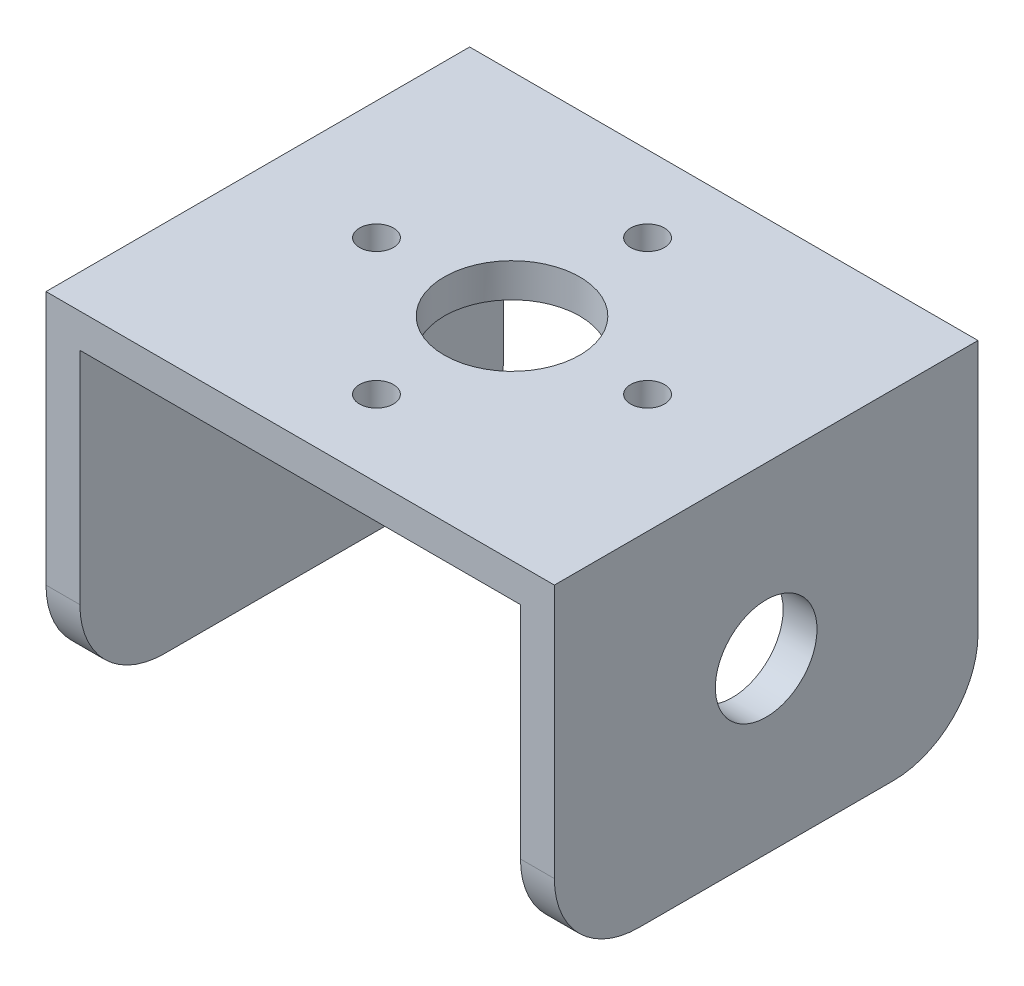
SolidWorks part; units mm, degrees
ref_plane "Front Plane" through (0, 0, 0) normal (0, 0, 1) x (1, 0, 0)
ref_plane "Top Plane" through (0, 0, 0) normal (0, 1, 0) x (1, 0, 0)
ref_plane "Right Plane" through (0, 0, 0) normal (1, 0, 0) x (0, 0, -1)
sketch "Sketch1" plane through (0, 0, 0) normal (0, 1, 0) x (1, 0, 0)
  line L1 (-15, -12.5) -> (15, -12.5)
  line L2 (-15, -12.5) -> (-15, 12.5)
  line L3 (-15, 12.5) -> (15, 12.5)
  line L4 (15, -12.5) -> (15, 12.5)
  line L5 (-15, -12.5) -> (15, 12.5) construction
  line L6 (-15, 12.5) -> (15, -12.5) construction
  point P0 (0, 0)
  dimension "D1" = 30
  dimension "D2" = 25
extrude "Boss-Extrude1" add sketch "Sketch1" against normal blind 20
shell "Shell1" thickness 2
sketch "Sketch2" plane through (0, 0, 0) normal (0, 1, 0) x (1, 0, 0)
  line L0 (0, 12.5) -> (0, -12.5) construction
  line L1 (15, 12.5) -> (-15, 12.5) construction
  line L2 (-15, -12.5) -> (15, -12.5) construction
  line L4 (-15, 12.5) -> (-15, -12.5) construction
  line L5 (-15, 0) -> (15, 0) construction
  line L6 (15, -12.5) -> (15, 12.5) construction
  circle A0 centre (0, 0) radius 4
  circle A1 centre (0, 8) radius 1
  circle A2 centre (8, 0) radius 1
  circle A3 centre (0, -8) radius 1
  circle A4 centre (-8, 0) radius 1
  point P26 (0, 0)
  dimension "D1" = 8
  dimension "D2" = 2
  dimension "D3" = 8
  dimension "D4" = 4
extrude "Cut-Extrude1" cut sketch "Sketch2" against normal up to next
sketch "Sketch3" plane through (15, 0, 0) normal (1, 0, 0) x (0, 0, -1)
  line L0 (0, 0) -> (0, -20) construction
  line L1 (-12.5, -20) -> (12.5, -20) construction
  circle A0 centre (0, -10) radius 3
  dimension "D1" = 10
  dimension "D2" = 6
extrude "Cut-Extrude2" cut sketch "Sketch3" against normal through all
fillet "Fillet1" radius 5 4 edges at (-14, -20, -12.5) (14, -20, -12.5) (-14, -20, 12.5) (14, -20, 12.5)
